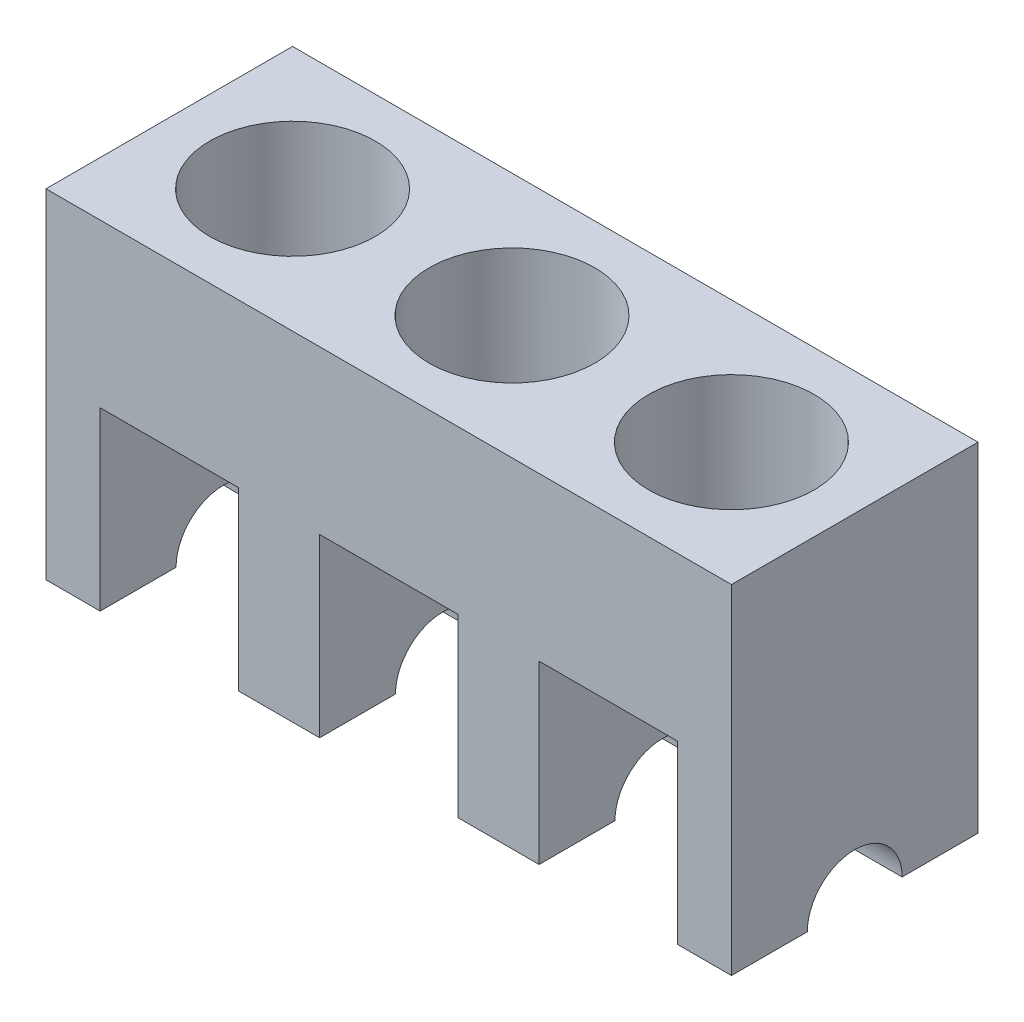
SolidWorks part; units mm, degrees
ref_plane "Front Plane" through (0, 0, 0) normal (0, 0, 1) x (1, 0, 0)
ref_plane "Top Plane" through (0, 0, 0) normal (0, 1, 0) x (1, 0, 0)
ref_plane "Right Plane" through (0, 0, 0) normal (1, 0, 0) x (0, 0, -1)
ref_plane "Plane1" through (0, 125, 0) normal (0, 1, 0) x (1, 0, 0)
sketch "Sketch2" plane through (0, 125, 0) normal (0, 1, 0) x (1, 0, 0)
  line L1 (-126.5, 45.5) -> (126.5, 45.5)
  line L2 (-126.5, 45.5) -> (-126.5, -45.5)
  line L3 (-126.5, -45.5) -> (126.5, -45.5)
  line L4 (126.5, 45.5) -> (126.5, -45.5)
  line L5 (-126.5, 45.5) -> (126.5, -45.5) construction
  line L6 (-126.5, -45.5) -> (126.5, 45.5) construction
  point P0 (0, 0)
  dimension "D1" = 91
  dimension "D2" = 253
extrude "Boss-Extrude1" add sketch "Sketch2" against normal blind 125
sketch "Sketch3" plane through (0, 125, 0) normal (0, 1, 0) x (1, 0, 0)
  line L0 (-81, 0) -> (81, 0) construction
  line L1 (-126.5, 45.5) -> (-126.5, -45.5) construction
  circle A0 centre (-81, 0) radius 30.55
  circle A1 centre (0, 0) radius 30.55
  circle A2 centre (81, 0) radius 30.55
  point P4 (0, 0)
  dimension "D1" = 61.1
  dimension "D2" = 81
  dimension "D3" = 45.5
extrude "Cut-Extrude1" cut sketch "Sketch3" against normal blind 81
sketch "Sketch4" plane through (0, 0, 0) normal (0, 0, 1) x (1, 0, 0)
  line L0 (-126.5, 0) -> (126.5, 0) construction
  line L1 (-106.5, 65) -> (-55.5, 65)
  line L2 (-106.5, 65) -> (-106.5, -65)
  line L3 (-106.5, -65) -> (-55.5, -65)
  line L4 (-55.5, 65) -> (-55.5, -65)
  line L5 (-106.5, 65) -> (-55.5, -65) construction
  line L6 (-106.5, -65) -> (-55.5, 65) construction
  line L7 (126.5, 0) -> (126.5, 125) construction
  line L8 (55.5, 65) -> (106.5, 65)
  line L9 (55.5, 65) -> (55.5, -65)
  line L10 (55.5, -65) -> (106.5, -65)
  line L11 (106.5, 65) -> (106.5, -65)
  line L12 (55.5, 65) -> (106.5, -65) construction
  line L13 (55.5, -65) -> (106.5, 65) construction
  line L14 (-25.5, 65) -> (25.5, 65)
  line L15 (-25.5, 65) -> (-25.5, -65)
  line L16 (-25.5, -65) -> (25.5, -65)
  line L17 (25.5, 65) -> (25.5, -65)
  line L18 (-25.5, 65) -> (25.5, -65) construction
  line L19 (-25.5, -65) -> (25.5, 65) construction
  point P0 (-81, 0)
  point P7 (81, 0)
  point P12 (0, 0)
  dimension "D1" = 51
  dimension "D2" = 51
  dimension "D3" = 51
  dimension "D4" = 65
  dimension "D5" = 30
  dimension "D6" = 30
  dimension "D7" = 20
extrude "Cut-Extrude2" cut sketch "Sketch4" against normal through all both and the other way through all
sketch "Sketch5" plane through (0, 0, 0) normal (1, 0, 0) x (0, 0, -1)
  line L0 (-45.5, 0) -> (45.5, 0) construction
  circle A0 centre (0, 0) radius 17.5
  dimension "D1" = 35
extrude "Cut-Extrude3" cut sketch "Sketch5" against normal through all both and the other way through all
